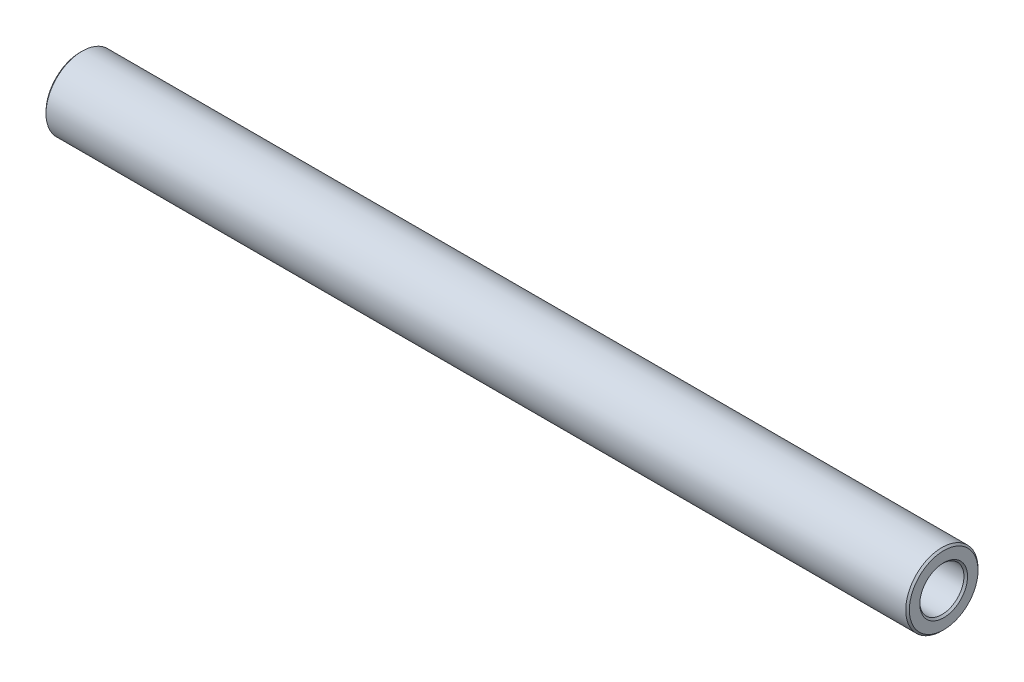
SolidWorks part; units mm, degrees
ref_plane "Спереди" through (0, 0, 0) normal (0, 0, 1) x (1, 0, 0)
ref_plane "Сверху" through (0, 0, 0) normal (0, 1, 0) x (1, 0, 0)
ref_plane "Справа" through (0, 0, 0) normal (1, 0, 0) x (0, 0, -1)
sketch "Эскиз1" plane through (0, 0, 0) normal (1, 0, 0) x (0, 0, -1)
  circle A0 centre (0, 0) radius 3.05
  circle A1 centre (0, 0) radius 5
  dimension "D1" = 6.1
  dimension "D2" = 10
extrude "Бобышка-Вытянуть1" add sketch "Эскиз1" along normal blind 119.5
chamfer "Фаска1" distance 0.25 angle 45 4 edges at (0, 0, -3.05) (119.5, 0, -3.05) (0, 0, -5) (119.5, 0, -5)
